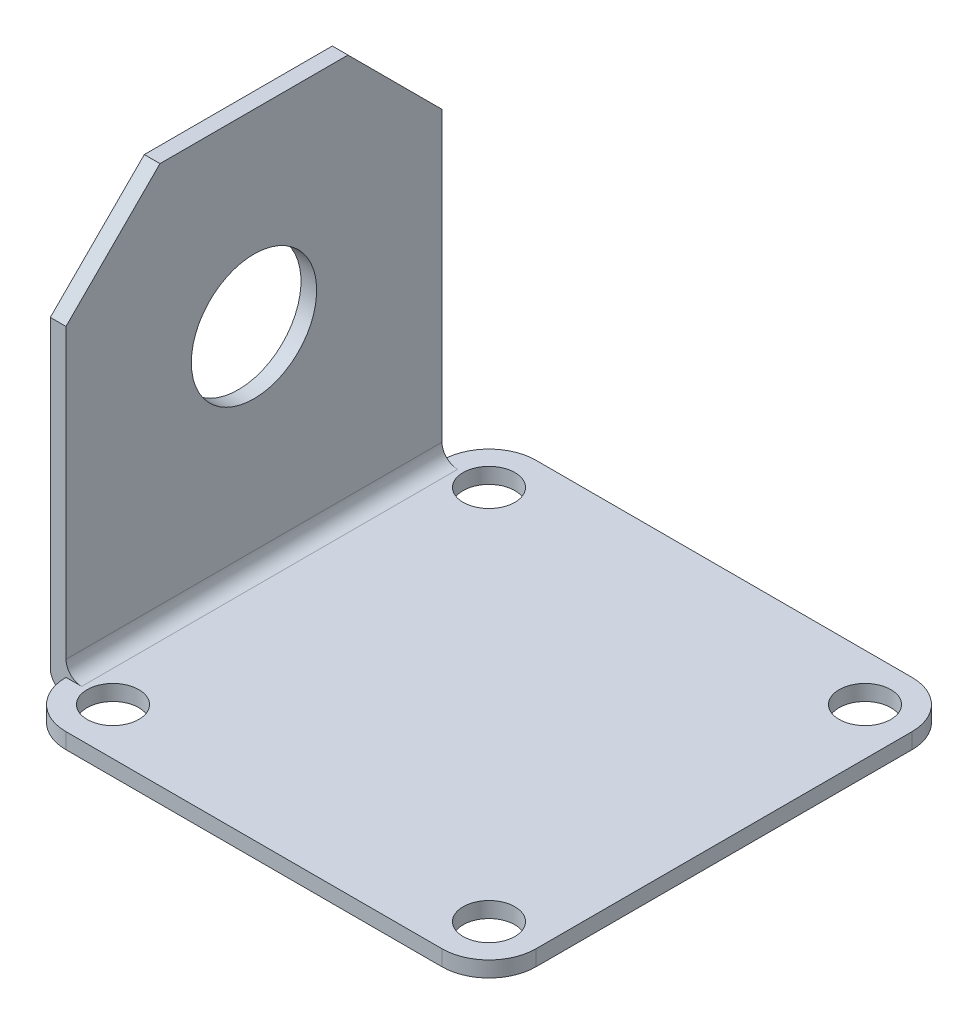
SolidWorks part; units mm, degrees
ref_plane "Plan de face" through (0, 0, 0) normal (0, 0, 1) x (1, 0, 0)
ref_plane "Plan de dessus" through (0, 0, 0) normal (0, 1, 0) x (1, 0, 0)
ref_plane "Plan de droite" through (0, 0, 0) normal (1, 0, 0) x (0, 0, -1)
sketch "Esquisse1" plane through (0, 0, 0) normal (0, 1, 0) x (1, 0, 0)
  line L0 (-53.5335, 0) -> (79.5045, 0) construction
  line L1 (0, -29.1596) -> (0, 49.6308) construction
  line L2 (30, 49.6308) -> (30, -29.1596) construction
  line L3 (64.0321, 15) -> (-16.1865, 15) construction
  line L4 (64.0321, -15) -> (-19.5191, -15) construction
  line L5 (-1, 49.6308) -> (-1, -29.1596) construction
  line L6 (-28, 44.7566) -> (-28, -29.1596) construction
  line L7 (-62.1278, 12) -> (2.9508, 12) construction
  line L8 (-62.1278, -12) -> (2.9508, -12) construction
  line L9 (15, 25.9738) -> (15, -6.0112) construction
  line L10 (27, -9.062) -> (27, -18.5515) construction
  line L11 (23.3953, -12) -> (33.0993, -12) construction
  line L12 (0, 12) -> (-1, 12)
  line L13 (-1, 12) -> (-1, -12)
  line L14 (-1, -12) -> (0, -12)
  line L20 (3, -15) -> (27, -15)
  line L22 (30, -12) -> (30, 12)
  line L23 (27, 15) -> (3, 15)
  circle A0 centre (27, -12) radius 1.65
  circle A1 centre (3, -12) radius 1.65
  circle A2 centre (3, 12) radius 1.65
  circle A3 centre (27, 12) radius 1.65
  arc A5 (30, 12) -> (27, 15) centre (27, 12) ccw
  arc A6 (27, -15) -> (30, -12) centre (27, -12) ccw
  arc A7 (0, -12) -> (3, -15) centre (3, -12) ccw
  arc A8 (3, 15) -> (0, 12) centre (3, 12) ccw
  dimension "D14" = 3
  dimension "D1" = 30
  dimension "D2" = 15
  dimension "D3" = 30
  dimension "D4" = 15
  dimension "D5" = 12
  dimension "D6" = 24
  dimension "D7" = 1
  dimension "D8" = 3
  dimension "D9" = 3
extrude "Extrusion1" add sketch "Esquisse1" along normal blind 26.4
sketch "Esquisse13" plane through (-1, 0, 0) normal (-1, 0, 0) x (0, 0, 1)
  line L0 (0, -6.0194) -> (0, 41.0168) construction
  line L1 (-21.8636, 26.4) -> (26.6088, 26.4) construction
  line L2 (-6, 33.0577) -> (-6, 11.2152) construction
  line L3 (26.6088, 20.4) -> (-22.9408, 20.4) construction
  line L4 (-8.0998, 14.4) -> (33.4907, 14.4) construction
  line L5 (-12, 33.0577) -> (-12, -8.3533) construction
  line L6 (-12, 20.4) -> (-6, 26.4)
  line L7 (-6, 26.4) -> (-6, 27.289)
  line L8 (-6, 27.289) -> (-12.889, 27.289)
  line L9 (-12.889, 27.289) -> (-12.889, 20.4)
  line L10 (-12.889, 20.4) -> (-12, 20.4)
  line L11 (12.889, 27.289) -> (12.889, 20.4)
  line L12 (6, 27.289) -> (12.889, 27.289)
  line L13 (6, 26.4) -> (6, 27.289)
  line L14 (12, 20.4) -> (6, 26.4)
  line L15 (12.889, 20.4) -> (12, 20.4)
  circle A0 centre (0, 14.4) radius 4
  dimension "D1" = 6
  dimension "D2" = 6
  dimension "D3" = 12
sketch "Esquisse14" plane through (0, 26.4, 0) normal (0, 1, 0) x (-1, 0, 0)
  line L0 (0, 20.4492) -> (0, -21.7206) construction
  line L2 (0, -16.5358) -> (-31.4371, -16.5358)
  line L3 (0, -16.5358) -> (0, 16.2322)
  line L4 (0, 16.2322) -> (-31.4371, 16.2322)
  line L5 (-31.4371, -16.5358) -> (-31.4371, 16.2322)
extrude "Enlèv. mat.-Extru.1" cut sketch "Esquisse14" against normal blind 25.4
extrude "Enlèv. mat.-Extru.2" cut sketch "Esquisse13" against normal blind 2
fillet "Congé1" radius 1 4 edges at (-0.5, 0, 12) (-1, 0, 0) (0, 1, 0) (-0.5, 0, -12)
sketch "Esquisse15" plane through (0, 0, 12) normal (0, 0, 1) x (1, 0, 0)
  text T0 "www.a4.fr" font "Arial" height 0.01
extrude "Enlèv. mat.-Extru.3" cut sketch "Esquisse15" against normal blind 0.01
sketch "Esquisse17" plane through (0, 0, -12) normal (0, 0, -1) x (-1, 0, 0)
  text T0 "www.a4.fr" font "Arial" height 0.01
extrude "Enlèv. mat.-Extru.4" cut sketch "Esquisse17" against normal blind 0.01
